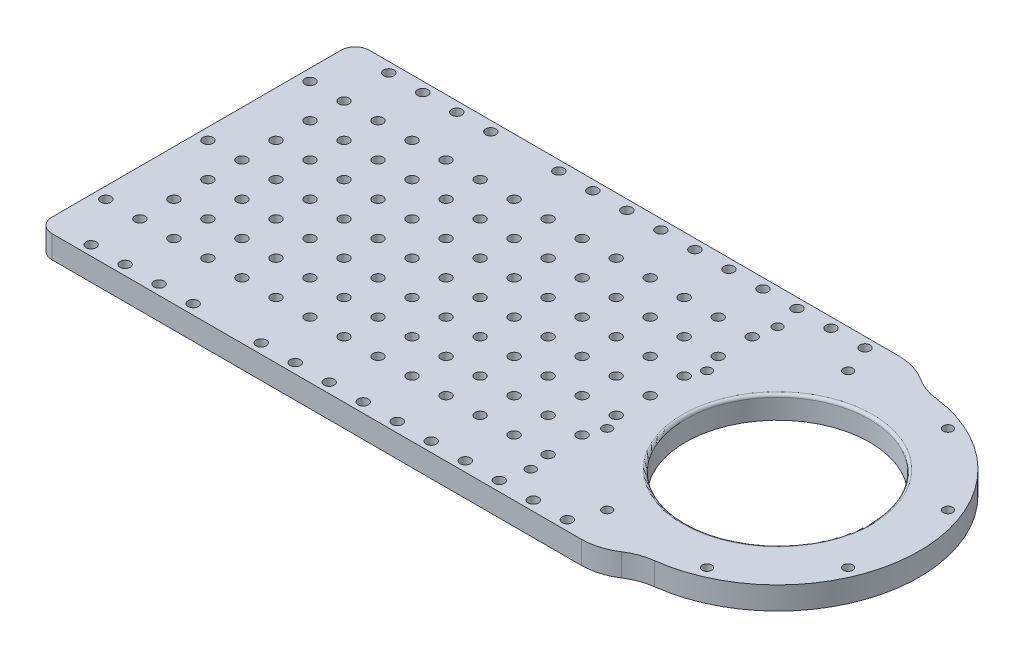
SolidWorks part; units mm, degrees
ref_plane "Front Plane" through (0, 0, 0) normal (0, 0, 1) x (1, 0, 0)
ref_plane "Top Plane" through (0, 0, 0) normal (0, 1, 0) x (1, 0, 0)
ref_plane "Right Plane" through (0, 0, 0) normal (1, 0, 0) x (0, 0, -1)
sketch "Sketch1" plane through (0, 0, 0) normal (0, 1, 0) x (1, 0, 0)
  line L1 (-100, 56) -> (100, 56)
  line L2 (-100, 56) -> (-100, -56)
  line L3 (-100, -56) -> (100, -56)
  line L4 (100, 56) -> (100, -56)
  line L5 (-100, 56) -> (100, -56) construction
  line L6 (-100, -56) -> (100, 56) construction
  point P0 (0, 0)
  dimension "D1" = 200
  dimension "D2" = 112
extrude "Boss-Extrude1" add sketch "Sketch1" along normal blind 8
sketch "Sketch3" plane through (0, 0, 0) normal (0, 1, 0) x (1, 0, 0)
  line L0 (-100, 0) -> (-110, 0)
  line L1 (-100, 56) -> (-100, -56) construction
  line L2 (-110, 25) -> (-110, -25)
  line L3 (-110, 25) -> (-100, 56)
  line L4 (-110, -25) -> (-100, -56)
  line L5 (-100, -56) -> (-100, 56)
  point P8 (-110, 0)
  dimension "D1" = 50
extrude "Boss-Extrude2" add sketch "Sketch3" along normal blind 8 contours L0 L5 L3 L2 | L4 L5 L0 L2
fillet "Fillet1" radius 10 4 edges at (-100, 4, 56) (-110, 4, 25) (-110, 4, -25) (-100, 4, -56)
sketch "Sketch5" plane through (0, 0, 0) normal (0, 1, 0) x (1, 0, 0)
  line L1 (100, 56) -> (157.9995, 56)
  line L2 (100, 56) -> (100, -56)
  line L3 (100, -56) -> (157.9995, -56)
  line L4 (157.9995, 56) -> (157.9995, -56)
  dimension "D1" = 112
extrude "Boss-Extrude3" add sketch "Sketch5" along normal blind 8
sketch "Sketch8" plane through (0, 8, 0) normal (0, 1, 0) x (1, 0, 0)
  line L0 (106.9378, 56) -> (106.9378, -56)
  line L1 (157.9995, 56) -> (-92.7184, 56) construction
  line L2 (-92.7184, -56) -> (157.9995, -56) construction
  line L3 (106.9378, 0) -> (156.9378, 0)
  line L4 (106.9378, -56) -> (131.9378, -56)
  line L5 (131.9378, -56) -> (156.9378, -50)
  line L6 (131.9378, 56) -> (156.9378, 50)
  line L7 (106.9378, 56) -> (131.9378, 56)
  circle A0 centre (156.9378, 0) radius 50
  dimension "D1" = 25
extrude "Boss-Extrude4" add sketch "Sketch8" against normal blind 8 contours A0 M16
fillet "Fillet2" radius 20 2 edges at (157.9995, 4, 56) (157.9995, 4, -56)
fillet "Fillet3" radius 20 2 edges at (157.9995, 4, 49.9887) (157.9995, 4, -49.9887)
sketch "Sketch10" plane through (0, 8, 0) normal (0, 1, 0) x (1, 0, 0)
  line L0 (110.9378, 0) -> (202.9378, 0)
  line L1 (114.4408, 17.6069) -> (114.4379, -17.6)
  line L2 (-92.7184, -56) -> (143.7056, -56) construction
  circle A0 centre (156.9378, 0) radius 46
  circle A3 centre (114.4408, 17.6069) radius 1.65
  circle A4 centre (139.3378, 42.4999) radius 1.65
  circle A5 centre (174.5447, 42.497) radius 1.65
  circle A6 centre (199.4377, 17.6) radius 1.65
  circle A7 centre (199.4349, -17.6069) radius 1.65
  circle A8 centre (174.5378, -42.4999) radius 1.65
  circle A9 centre (139.331, -42.497) radius 1.65
  circle A10 centre (114.4379, -17.6) radius 1.65
  dimension "D1" = 8
  dimension "D5" = 3.3
  dimension "D3" = 92
  dimension "D4" = 17.6
  dimension "D2" = 35.2069
  dimension "D6" = 56
extrude "Cut-Extrude4" cut sketch "Sketch10" against normal blind 10 contours A10 | A3 | A4 | A5 | A9 | A8 | A7 | A6
sketch "Sketch11" plane through (0, 8, 0) normal (0, 1, 0) x (1, 0, 0)
  line L2 (139.331, -42.497) -> (139.289, -42.7462)
  line L4 (174.5378, -42.4999) -> (199.4349, -17.6069)
  line L8 (139.3378, 42.4999) -> (114.4408, 17.6069)
  line L9 (156.9378, 50) -> (106.9378, 50)
  line L10 (106.9378, 50) -> (106.9378, 0)
  line L11 (106.9378, 0) -> (106.9378, -50)
  line L12 (106.9378, -50) -> (156.9378, -50)
  line L13 (106.9378, 50) -> (113.4008, 43.537)
  line L14 (106.9378, 0) -> (113.4008, 0)
  circle A1 centre (113.4008, 43.537) radius 1.65
  circle A2 centre (113.4008, -43.537) radius 1.65
extrude "Cut-Extrude5" cut sketch "Sketch11" against normal blind 10
sketch "Sketch13" plane through (0, 8, 0) normal (0, 1, 0) x (1, 0, 0)
  line L0 (-106.5, 0) -> (-84.1762, 0)
  line L5 (-98.9045, 47.9955) -> (-106.1861, 25.4225)
  line L7 (-98.9045, 47.9955) -> (-106.1861, 25.4225)
  line L10 (-92.7184, -52.5) -> (143.7056, -52.5)
  line L11 (143.7056, 52.5) -> (-92.7184, 52.5)
  line L13 (-106.5, 23.427) -> (-106.5, -23.427)
  line L14 (-106.5, 23.427) -> (-106.5, -23.427)
  line L15 (-92.7184, -52.5) -> (143.7056, -52.5)
  line L16 (143.7056, 52.5) -> (-92.7184, 52.5)
  line L20 (-106.1861, -25.4225) -> (-98.9045, -47.9955)
  line L21 (-106.1861, -25.4225) -> (-98.9045, -47.9955)
  circle A0 centre (-92.7184, -52.5) radius 1.8
  circle A1 centre (-80.7184, -52.5) radius 1.8
  circle A2 centre (-80.7184, 52.5) radius 1.8
  circle A3 centre (-68.7184, -52.5) radius 1.8
  circle A4 centre (-68.7184, 52.5) radius 1.8
  circle A5 centre (-56.7184, -52.5) radius 1.8
  circle A6 centre (-56.7184, 52.5) radius 1.8
  circle A7 centre (-44.7184, -52.5) radius 1.8
  circle A8 centre (-44.7184, 52.5) radius 1.8
  circle A9 centre (-92.7184, 52.5) radius 1.8
  circle A10 centre (-32.7184, -52.5) radius 1.8
  circle A11 centre (-32.7184, 52.5) radius 1.8
  circle A12 centre (-20.7184, -52.5) radius 1.8
  circle A13 centre (-20.7184, 52.5) radius 1.8
  circle A14 centre (-8.7184, -52.5) radius 1.8
  circle A15 centre (-8.7184, 52.5) radius 1.8
  circle A16 centre (3.2816, -52.5) radius 1.8
  circle A17 centre (3.2816, 52.5) radius 1.8
  circle A36 centre (15.2816, -52.5) radius 1.8
  circle A37 centre (15.2816, 52.5) radius 1.8
  circle A38 centre (27.2816, -52.5) radius 1.8
  circle A39 centre (27.2816, 52.5) radius 1.8
  circle A40 centre (39.2816, -52.5) radius 1.8
  circle A41 centre (39.2816, 52.5) radius 1.8
  circle A42 centre (51.2816, -52.5) radius 1.8
  circle A43 centre (51.2816, 52.5) radius 1.8
  circle A44 centre (63.2816, -52.5) radius 1.8
  circle A45 centre (63.2816, 52.5) radius 1.8
  circle A46 centre (75.2816, -52.5) radius 1.8
  circle A47 centre (75.2816, 52.5) radius 1.8
  circle A48 centre (87.2816, -52.5) radius 1.8
  circle A49 centre (87.2816, 52.5) radius 1.8
  circle A50 centre (99.2816, -52.5) radius 1.8
  circle A51 centre (99.2816, 52.5) radius 1.8
  circle A52 centre (111.2816, -52.5) radius 1.8
  circle A53 centre (111.2816, 52.5) radius 1.8
  circle A54 centre (123.2816, -52.5) radius 1.8
  circle A55 centre (123.2816, 52.5) radius 1.8
  circle A56 centre (135.2816, -52.5) radius 1.8
  circle A57 centre (135.2816, 52.5) radius 1.8
  arc A58 (143.7056, -52.5) -> (152.7479, -49.8017) centre (143.7056, -36) ccw
  arc A59 (143.7056, -52.5) -> (152.7479, -49.8017) centre (143.7056, -36) ccw
  arc A60 (162.7095, -46.1404) -> (152.7479, -49.8017) centre (165.6263, -69.4587) ccw
  arc A61 (162.7095, -46.1404) -> (152.7479, -49.8017) centre (165.6263, -69.4587) ccw
  arc A62 (162.7095, -46.1404) -> (162.7095, 46.1404) centre (156.9378, 0) ccw
  arc A63 (162.7095, -46.1404) -> (162.7095, 46.1404) centre (156.9378, 0) ccw
  arc A64 (152.7479, 49.8017) -> (162.7095, 46.1404) centre (165.6263, 69.4587) ccw
  arc A65 (152.7479, 49.8017) -> (162.7095, 46.1404) centre (165.6263, 69.4587) ccw
  arc A66 (152.7479, 49.8017) -> (143.7056, 52.5) centre (143.7056, 36) ccw
  arc A67 (152.7479, 49.8017) -> (143.7056, 52.5) centre (143.7056, 36) ccw
  arc A68 (-92.7184, 52.5) -> (-98.9045, 47.9955) centre (-92.7184, 46) ccw
  arc A69 (-92.7184, 52.5) -> (-98.9045, 47.9955) centre (-92.7184, 46) ccw
  arc A70 (-106.1861, 25.4225) -> (-106.5, 23.427) centre (-100, 23.427) ccw
  arc A71 (-106.1861, 25.4225) -> (-106.5, 23.427) centre (-100, 23.427) ccw
  arc A72 (-106.5, -23.427) -> (-106.1861, -25.4225) centre (-100, -23.427) ccw
  arc A73 (-106.5, -23.427) -> (-106.1861, -25.4225) centre (-100, -23.427) ccw
  arc A74 (-98.9045, -47.9955) -> (-92.7184, -52.5) centre (-92.7184, -46) ccw
  arc A75 (-98.9045, -47.9955) -> (-92.7184, -52.5) centre (-92.7184, -46) ccw
  dimension "D2" = 20
  dimension "D1" = 3.5
extrude "Cut-Extrude7" cut sketch "Sketch13" against normal blind 10 contours A9 | A2 | A4 | A6 | A13 | A15 | A17 | A39 | A41 | A43 | A45 | A47 | A49 | A51 | A53 | A55 | A57 | A56 | A54 | A52 | A50 | A48 | A46 | A40 | A38 | A16 | A14 | A12 | A5 | A0 | A1 | A3 | A44 | A42 | A10 | A11
sketch "Sketch14" plane through (0, 8, 0) normal (0, 1, 0) x (1, 0, 0)
  line L0 (-110, 0) -> (-70, 0)
  line L1 (-110, 23.427) -> (-110, -23.427) construction
  line L2 (-70, 0) -> (30, 0)
  circle A0 centre (-20, 0) radius 1.8
  circle A1 centre (-8, 0) radius 1.8
  circle A2 centre (4, 0) radius 1.8
  circle A3 centre (16, 0) radius 1.8
  circle A4 centre (28, 0) radius 1.8
  circle A5 centre (-32, 0) radius 1.8
  circle A6 centre (-44, 0) radius 1.8
  circle A7 centre (-56, 0) radius 1.8
  circle A8 centre (-68, 0) radius 1.8
  circle A9 centre (-68, 12) radius 1.8
  circle A17 centre (28, 12) radius 1.8
  circle A18 centre (-68, 24) radius 1.8
  circle A26 centre (28, 24) radius 1.8
  circle A27 centre (-68, 36) radius 1.8
  circle A28 centre (-56, 36) radius 1.8
  circle A29 centre (-44, 36) radius 1.8
  circle A30 centre (-32, 36) radius 1.8
  circle A31 centre (-20, 36) radius 1.8
  circle A32 centre (-8, 36) radius 1.8
  circle A33 centre (4, 36) radius 1.8
  circle A34 centre (16, 36) radius 1.8
  circle A35 centre (28, 36) radius 1.8
  circle A36 centre (-68, -12) radius 1.8
  circle A44 centre (28, -12) radius 1.8
  circle A45 centre (-68, -24) radius 1.8
  circle A53 centre (28, -24) radius 1.8
  circle A54 centre (-68, -36) radius 1.8
  circle A55 centre (-56, -36) radius 1.8
  circle A56 centre (-44, -36) radius 1.8
  circle A57 centre (-32, -36) radius 1.8
  circle A58 centre (-20, -36) radius 1.8
  circle A59 centre (-8, -36) radius 1.8
  circle A60 centre (4, -36) radius 1.8
  circle A61 centre (16, -36) radius 1.8
  circle A62 centre (28, -36) radius 1.8
  circle A63 centre (40, 36) radius 1.8
  circle A64 centre (40, 24) radius 1.8
  circle A65 centre (40, 12) radius 1.8
  circle A66 centre (40, 0) radius 1.8
  circle A69 centre (40, -36) radius 1.8
  circle A70 centre (52, 36) radius 1.8
  circle A73 centre (52, 0) radius 1.8
  circle A76 centre (52, -36) radius 1.8
  circle A77 centre (64, 36) radius 1.8
  circle A80 centre (64, 0) radius 1.8
  circle A83 centre (64, -36) radius 1.8
  circle A84 centre (76, 36) radius 1.8
  circle A87 centre (76, 0) radius 1.8
  circle A90 centre (76, -36) radius 1.8
  circle A91 centre (88, 36) radius 1.8
  circle A94 centre (88, 0) radius 1.8
  circle A97 centre (88, -36) radius 1.8
  circle A98 centre (100, 36) radius 1.8
  circle A101 centre (100, 0) radius 1.8
  circle A104 centre (100, -36) radius 1.8
  circle A105 centre (112, 36) radius 1.8
  circle A106 centre (112, 24) radius 1.8
  circle A107 centre (112, 12) radius 1.8
  circle A108 centre (112, 0) radius 1.8
  circle A109 centre (112, -12) radius 1.8
  circle A110 centre (112, -24) radius 1.8
  circle A111 centre (112, -36) radius 1.8
  circle A112 centre (-56, -12) radius 1.8
  circle A113 centre (-44, -12) radius 1.8
  circle A114 centre (-32, -12) radius 1.8
  circle A115 centre (-20, -12) radius 1.8
  circle A116 centre (-8, -12) radius 1.8
  circle A117 centre (4, -12) radius 1.8
  circle A118 centre (16, -12) radius 1.8
  circle A119 centre (-56, -24) radius 1.8
  circle A120 centre (-44, -24) radius 1.8
  circle A121 centre (-32, -24) radius 1.8
  circle A122 centre (-20, -24) radius 1.8
  circle A123 centre (-8, -24) radius 1.8
  circle A124 centre (4, -24) radius 1.8
  circle A125 centre (16, -24) radius 1.8
  circle A126 centre (-56, 12) radius 1.8
  circle A127 centre (-44, 12) radius 1.8
  circle A128 centre (-32, 12) radius 1.8
  circle A129 centre (-20, 12) radius 1.8
  circle A130 centre (-8, 12) radius 1.8
  circle A131 centre (4, 12) radius 1.8
  circle A132 centre (16, 12) radius 1.8
  circle A133 centre (-56, 24) radius 1.8
  circle A134 centre (-44, 24) radius 1.8
  circle A135 centre (-32, 24) radius 1.8
  circle A136 centre (-20, 24) radius 1.8
  circle A137 centre (-8, 24) radius 1.8
  circle A138 centre (4, 24) radius 1.8
  circle A139 centre (16, 24) radius 1.8
  circle A140 centre (52, 24) radius 1.8
  circle A141 centre (52, 12) radius 1.8
  circle A142 centre (64, 24) radius 1.8
  circle A143 centre (64, 12) radius 1.8
  circle A144 centre (76, 24) radius 1.8
  circle A145 centre (76, 12) radius 1.8
  circle A146 centre (88, 24) radius 1.8
  circle A147 centre (88, 12) radius 1.8
  circle A148 centre (100, 24) radius 1.8
  circle A149 centre (100, 12) radius 1.8
  circle A150 centre (40, -12) radius 1.8
  circle A151 centre (40, -24) radius 1.8
  circle A152 centre (52, -12) radius 1.8
  circle A153 centre (52, -24) radius 1.8
  circle A154 centre (64, -12) radius 1.8
  circle A155 centre (64, -24) radius 1.8
  circle A156 centre (76, -12) radius 1.8
  circle A157 centre (76, -24) radius 1.8
  circle A158 centre (88, -12) radius 1.8
  circle A159 centre (88, -24) radius 1.8
  circle A160 centre (100, -12) radius 1.8
  circle A161 centre (100, -24) radius 1.8
  circle A162 centre (40, -12) radius 1.8
  circle A163 centre (40, -24) radius 1.8
  dimension "D1" = 5
  dimension "D2" = 5
  dimension "D3" = 4
  dimension "D4" = 4
  dimension "D5" = 8
  dimension "D6" = 3
extrude "Cut-Extrude12" cut sketch "Sketch14" against normal blind 10 contours L2 A0 | L2 A0 | A73 | A80 | A63 | A70 | A27 | A18 | A28 | A29 | A30 | A31 | A32 | A33 | A34 | A9 | A8 | A7 | A36 | A45 | A54 | A55 | A56 | A57 | A58 | A59 | A60 | A61 | A62 | A53 | A44 | A4 | A3 | A2 | A1 | A5 | A6 | A17 | A26 | A64 | A65 | A66 | A162 | A35 | A77 | A84 | A91 | A98 | A105 | A106 | A111 | A104 | A97 | A90 | A83 | A76 | A69 | A163 | A87 | A94 | A101 | A108 | A109 | A110 | A107
sketch "Sketch15" plane through (0, 8, 0) normal (0, 1, 0) x (1, 0, 0)
  line L0 (206.9378, 0) -> (-48.0622, 0)
  line L2 (-48.0622, 62.6241) -> (-123.4657, 62.6241)
  line L3 (-48.0622, 62.6241) -> (-48.0622, -83.2305)
  line L4 (-48.0622, -83.2305) -> (-123.4657, -83.2305)
  line L5 (-123.4657, 62.6241) -> (-123.4657, -83.2305)
  arc A0 (163.1439, -49.6134) -> (163.1439, 49.6134) centre (156.9378, 0) ccw construction
  dimension "D1" = 255
extrude "Cut-Extrude13" cut sketch "Sketch15" against normal blind 10 contours L3 L2 L5 L4
fillet "Fillet4" radius 5 2 edges at (-48.0622, 4, -56) (-48.0622, 4, 56)
sketch "Sketch16" plane through (0, 8, 0) normal (0, 1, 0) x (1, 0, 0)
  circle A0 centre (156.9378, 0) radius 32.5
  dimension "D1" = 65
extrude "Cut-Extrude16" cut sketch "Sketch16" against normal blind 10
fillet "Fillet8" radius 1 1 edges at (156.9378, 8, 32.5)
sketch "Sketch17" plane through (0, 8, 0) normal (0, 1, 0) x (1, 0, 0)
  circle A0 centre (-32, 36) radius 1.8
  circle A1 centre (-20, 36) radius 1.8
  circle A2 centre (-8, 36) radius 1.8
  circle A3 centre (4, 36) radius 1.8
  circle A4 centre (16, 36) radius 1.8
  circle A5 centre (28, 36) radius 1.8
  circle A6 centre (40, 36) radius 1.8
  circle A7 centre (52, 36) radius 1.8
  circle A8 centre (64, 36) radius 1.8
  circle A9 centre (76, 36) radius 1.8
  circle A10 centre (88, 36) radius 1.8
  circle A11 centre (100, 36) radius 1.8
  circle A12 centre (-20, 24) radius 1.8
  circle A13 centre (-8, 24) radius 1.8
  circle A14 centre (4, 24) radius 1.8
  circle A15 centre (16, 24) radius 1.8
  circle A16 centre (28, 24) radius 1.8
  circle A17 centre (40, 24) radius 1.8
  circle A18 centre (52, 24) radius 1.8
  circle A19 centre (64, 24) radius 1.8
  circle A20 centre (76, 24) radius 1.8
  circle A21 centre (88, 24) radius 1.8
  circle A22 centre (100, 24) radius 1.8
  circle A23 centre (-20, 12) radius 1.8
  circle A24 centre (-8, 12) radius 1.8
  circle A25 centre (4, 12) radius 1.8
  circle A26 centre (16, 12) radius 1.8
  circle A27 centre (28, 12) radius 1.8
  circle A28 centre (40, 12) radius 1.8
  circle A29 centre (52, 12) radius 1.8
  circle A30 centre (64, 12) radius 1.8
  circle A31 centre (76, 12) radius 1.8
  circle A32 centre (88, 12) radius 1.8
  circle A33 centre (100, 12) radius 1.8
  circle A34 centre (-20, 0) radius 1.8
  circle A35 centre (-8, 0) radius 1.8
  circle A36 centre (4, 0) radius 1.8
  circle A37 centre (16, 0) radius 1.8
  circle A38 centre (28, 0) radius 1.8
  circle A39 centre (40, 0) radius 1.8
  circle A40 centre (52, 0) radius 1.8
  circle A41 centre (64, 0) radius 1.8
  circle A42 centre (76, 0) radius 1.8
  circle A43 centre (88, 0) radius 1.8
  circle A44 centre (100, 0) radius 1.8
  circle A45 centre (-20, -12) radius 1.8
  circle A46 centre (-8, -12) radius 1.8
  circle A47 centre (4, -12) radius 1.8
  circle A48 centre (16, -12) radius 1.8
  circle A49 centre (28, -12) radius 1.8
  circle A50 centre (40, -12) radius 1.8
  circle A51 centre (52, -12) radius 1.8
  circle A52 centre (64, -12) radius 1.8
  circle A53 centre (76, -12) radius 1.8
  circle A54 centre (88, -12) radius 1.8
  circle A55 centre (100, -12) radius 1.8
  circle A56 centre (-20, -24) radius 1.8
  circle A57 centre (-8, -24) radius 1.8
  circle A58 centre (4, -24) radius 1.8
  circle A59 centre (16, -24) radius 1.8
  circle A60 centre (28, -24) radius 1.8
  circle A61 centre (40, -24) radius 1.8
  circle A62 centre (52, -24) radius 1.8
  circle A63 centre (64, -24) radius 1.8
  circle A64 centre (76, -24) radius 1.8
  circle A65 centre (88, -24) radius 1.8
  circle A66 centre (100, -24) radius 1.8
  circle A67 centre (-20, -36) radius 1.8
  circle A68 centre (-8, -36) radius 1.8
  circle A69 centre (4, -36) radius 1.8
  circle A70 centre (16, -36) radius 1.8
  circle A71 centre (28, -36) radius 1.8
  circle A72 centre (40, -36) radius 1.8
  circle A73 centre (52, -36) radius 1.8
  circle A74 centre (64, -36) radius 1.8
  circle A75 centre (76, -36) radius 1.8
  circle A76 centre (88, -36) radius 1.8
  circle A77 centre (100, -36) radius 1.8
  circle A78 centre (-32, 24) radius 1.8
  circle A79 centre (-32, 12) radius 1.8
  circle A80 centre (-32, 0) radius 1.8
  circle A81 centre (-32, -12) radius 1.8
  circle A82 centre (-32, -24) radius 1.8
  circle A83 centre (-32, -36) radius 1.8
  dimension "D1" = 12
  dimension "D2" = 7
extrude "Cut-Extrude17" cut sketch "Sketch17" against normal blind 10
